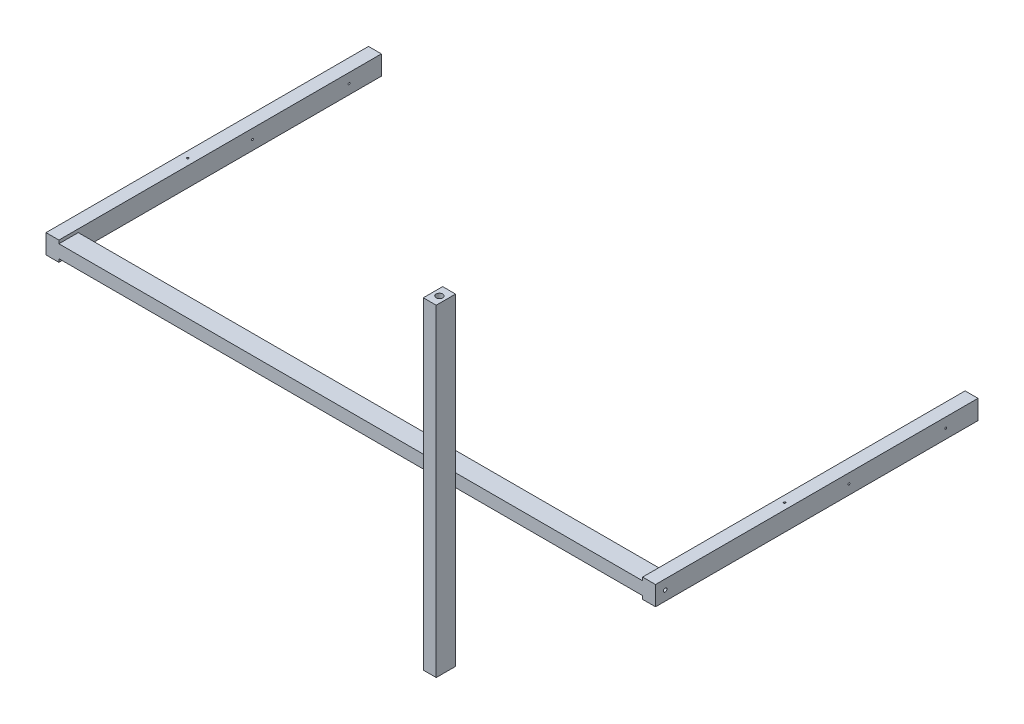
SolidWorks part; units mm, degrees
ref_plane "Plan de face" through (0, 0, 0) normal (0, 0, 1) x (1, 0, 0)
ref_plane "Plan de dessus" through (0, 0, 0) normal (0, 1, 0) x (1, 0, 0)
ref_plane "Plan de droite" through (0, 0, 0) normal (1, 0, 0) x (0, 0, -1)
sketch "Esquisse1" plane through (0, 0, 0) normal (0, 0, 1) x (1, 0, 0)
  line L0 (0, 0) -> (0, 181.1765) construction
  line L1 (-905, -30) -> (-945, -30)
  line L2 (-905, -30) -> (-905, 30)
  line L3 (-905, 30) -> (-945, 30)
  line L4 (-945, -30) -> (-945, 30)
  line L5 (-905, -30) -> (-945, 30) construction
  line L6 (-905, 30) -> (-945, -30) construction
  line L7 (905, 30) -> (945, -30) construction
  line L8 (905, -30) -> (945, 30) construction
  line L9 (945, -30) -> (945, 30)
  line L10 (905, 30) -> (945, 30)
  line L11 (905, -30) -> (905, 30)
  line L12 (905, -30) -> (945, -30)
  point P0 (-925, 0)
  point P12 (925, 0)
  dimension "D1" = 40
  dimension "D2" = 60
  dimension "D3" = 1810
extrude "Boss.-Extru.1" add sketch "Esquisse1" along normal blind 1000
sketch "Esquisse2" plane through (0, 0, 0) normal (0, 1, 0) x (1, 0, 0)
  line L0 (0, 0) -> (0, -417.2524) construction
  line L1 (-865, -940) -> (-905, -940) construction
  line L2 (-865, -940) -> (-865, -1000) construction
  line L3 (-865, -1000) -> (-905, -1000) construction
  line L4 (-905, -940) -> (-905, -1000) construction
  line L5 (-865, -940) -> (-905, -1000) construction
  line L6 (-865, -1000) -> (-905, -940) construction
  line L7 (865, -1000) -> (905, -940) construction
  line L8 (865, -940) -> (905, -1000) construction
  line L9 (905, -940) -> (905, -1000) construction
  line L10 (865, -1000) -> (905, -1000) construction
  line L11 (865, -940) -> (865, -1000) construction
  line L12 (865, -940) -> (905, -940) construction
  line L13 (-865, -1000) -> (865, -1000) construction
  line L14 (905, -1000) -> (905, 0) construction
  line L15 (285, -1000) -> (325, -1000)
  line L16 (285, -1000) -> (285, -1060)
  line L17 (285, -1060) -> (325, -1060)
  line L18 (325, -1000) -> (325, -1060)
  point P0 (-885, -970)
  point P13 (885, -970)
  point P18 (305, -1000)
  dimension "D1" = 40
  dimension "D2" = 60
  dimension "D3" = 40
  dimension "D4" = 60
  dimension "D5" = 600
extrude "Boss.-Extru.2" add sketch "Esquisse2" along normal mid plane 1000
sketch "Esquisse3" plane through (0, 0, 0) normal (1, 0, 0) x (0, 0, -1)
  line L0 (0, 0) -> (235.1476, 0) construction
  line L1 (-1060, 460) -> (-1000, 460) construction
  line L2 (-1060, 460) -> (-1060, 500) construction
  line L3 (-1060, 500) -> (-1000, 500) construction
  line L4 (-1000, 460) -> (-1000, 500) construction
  line L5 (-1060, 460) -> (-1000, 500) construction
  line L6 (-1060, 500) -> (-1000, 460) construction
  line L7 (-1060, -500) -> (-1000, -460) construction
  line L8 (-1060, -460) -> (-1000, -500) construction
  line L9 (-1000, -460) -> (-1000, -500) construction
  line L10 (-1060, -500) -> (-1000, -500) construction
  line L11 (-1060, -460) -> (-1060, -500) construction
  line L12 (-1060, -460) -> (-1000, -460) construction
  line L13 (-1000, -30) -> (-1000, 30) construction
  line L14 (-940, -20) -> (-1000, -20)
  line L15 (-940, -20) -> (-940, 20)
  line L16 (-940, 20) -> (-1000, 20)
  line L17 (-1000, -20) -> (-1000, 20)
  line L18 (-940, -20) -> (-1000, 20) construction
  line L19 (-940, 20) -> (-1000, -20) construction
  point P0 (-1030, 480)
  point P13 (-1030, -480)
  point P14 (-970, 0)
  dimension "D1" = 40
  dimension "D2" = 60
extrude "Boss.-Extru.3" add sketch "Esquisse3" along normal mid plane 1810
sketch "Esquisse4" plane through (0, -500, 0) normal (0, -1, 0) x (1, 0, 0)
  line L0 (905, 1060) -> (-905, 1060) construction
  line L2 (945, 1000) -> (945, 0) construction
  line L3 (0, 1060) -> (0, 1534.79) construction
  line L4 (905, 1000) -> (-905, 1000) construction
  line L5 (325, 1060) -> (325, 1000) construction
  circle A0 centre (305, 1030) radius 10.3434
  circle A1 centre (925, 580) radius 3
  circle A2 centre (-925, 580) radius 3
  dimension "D1" = 30
  dimension "D2" = 20
  dimension "D3" = 6
  dimension "D5" = 450
  dimension "D4" = 20
extrude "Enlèv. mat.-Extru.1" cut sketch "Esquisse4" against normal through all both and the other way through all
sketch "Esquisse5" plane through (-945, 0, 0) normal (-1, 0, 0) x (0, 0, 1)
  line L0 (1000, -30) -> (1000, -460) construction
  line L1 (940, 500) -> (940, 30) construction
  line L2 (970, 0) -> (1088.0225, 0) construction
  circle A0 centre (100, 0) radius 3
  circle A1 centre (400, 0) radius 3
  circle A2 centre (970, 0) radius 5.5
  circle A3 centre (970, 93.75) radius 5.5
  circle A4 centre (970, -93.75) radius 5.5
  dimension "D1" = 6
  dimension "D5" = 11
  dimension "D2" = 900
  dimension "D3" = 300
  dimension "D4" = 30
  dimension "D6" = 93.75
extrude "Enlèv. mat.-Extru.2" cut sketch "Esquisse5" against normal through all
